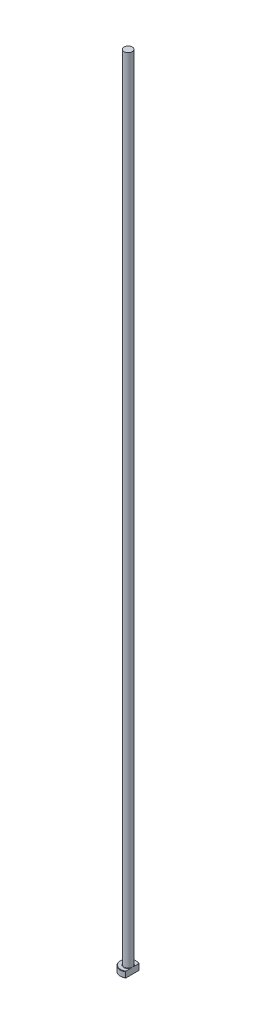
SolidWorks part; units mm, degrees
ref_plane "Front Plane" through (0, 0, 0) normal (0, 0, 1) x (1, 0, 0)
ref_plane "Top Plane" through (0, 0, 0) normal (0, 1, 0) x (1, 0, 0)
ref_plane "Right Plane" through (0, 0, 0) normal (1, 0, 0) x (0, 0, -1)
sketch "Sketch1" plane through (0, 0, 0) normal (0, 0, 1) x (1, 0, 0)
  line L0 (0, 259.9588) -> (0, -15.1925) construction
  line L1 (0, 0) -> (-4, 0)
  line L2 (-4, 0) -> (-4, 3)
  line L3 (-4, 3) -> (-2.05, 3)
  line L4 (-2.05, 3) -> (-2.05, 400)
  line L5 (-2.05, 400) -> (0, 400)
  line L6 (0, 400) -> (0, 0)
  dimension "L" = 400
  dimension "H" = 8
  dimension "T" = 3
  dimension "D" = 4.1
revolve "Revolve1" add sketch "Sketch1" angle 360 about L0
chamfer "Chamfer1" distance 0.2 angle 45 2 edges at (0, 3, 4) (0, 0, 4)
fillet "Fillet1" radius 0.2 1 edges at (0, 3, 2.05)
sketch "Sketch2" plane through (0, 0, 0) normal (0, 1, 0) x (1, 0, 0)
  line L0 (2.05, 3.4347) -> (2.05, -3.4347)
  circle A0 centre (0, 0) radius 4 construction
  arc A1 (2.05, -3.4347) -> (2.05, 3.4347) centre (0, 0) ccw
  circle A2 centre (0, 0) radius 2.05 construction
extrude "KEY" cut sketch "Sketch2" along normal through all
